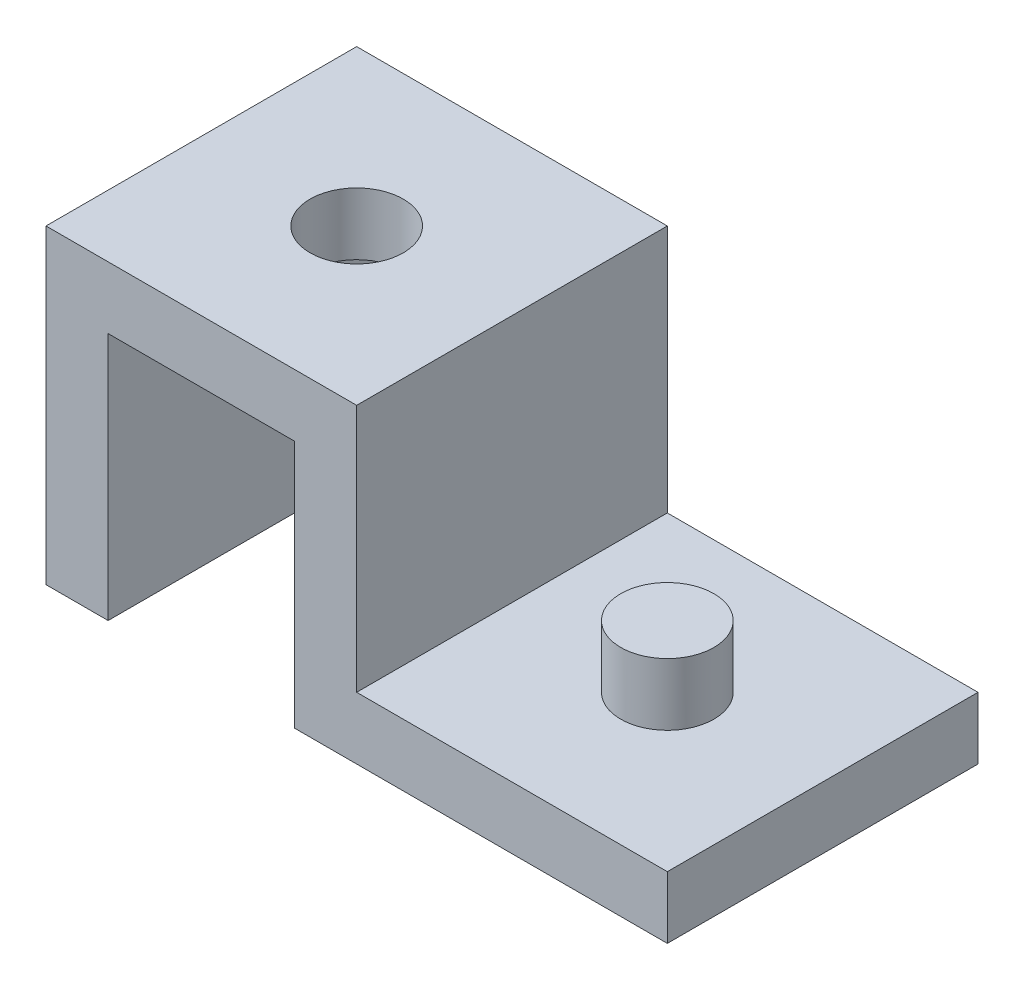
SolidWorks part; units mm, degrees
ref_plane "正面" through (0, 0, 0) normal (0, 0, 1) x (1, 0, 0)
ref_plane "平面" through (0, 0, 0) normal (0, 1, 0) x (1, 0, 0)
ref_plane "右側面" through (0, 0, 0) normal (1, 0, 0) x (0, 0, -1)
sketch "ｽｹｯﾁ1" plane through (0, 0, 0) normal (0, 1, 0) x (1, 0, 0)
  line L1 (0, 0) -> (100, 0)
  line L2 (0, 0) -> (0, 50)
  line L3 (0, 50) -> (100, 50)
  line L4 (100, 0) -> (100, 50)
  dimension "D1" = 100
  dimension "D2" = 50
extrude "押し出し1" add sketch "ｽｹｯﾁ1" along normal blind 50
sketch "ｽｹｯﾁ2" plane through (0, 0, 0) normal (0, 0, 1) x (1, 0, 0)
  line L0 (0, 0) -> (100, 0) construction
  line L1 (100, 50) -> (50, 50)
  line L2 (100, 50) -> (100, 10)
  line L3 (100, 10) -> (50, 10)
  line L4 (50, 50) -> (50, 10)
  line L5 (0, 50) -> (0, 0) construction
  dimension "D1" = 10
  dimension "D2" = 50
extrude "ｶｯﾄ - 押し出し1" cut sketch "ｽｹｯﾁ2" against normal through all
sketch "ｽｹｯﾁ3" plane through (0, 0, 0) normal (0, 0, 1) x (1, 0, 0)
  line L0 (0, 0) -> (100, 0) construction
  line L1 (10, 0) -> (40, 0)
  line L2 (10, 0) -> (10, 40)
  line L3 (10, 40) -> (40, 40)
  line L4 (40, 0) -> (40, 40)
  line L5 (0, 50) -> (0, 0) construction
  dimension "D1" = 10
  dimension "D2" = 30
  dimension "D3" = 40
extrude "ｶｯﾄ - 押し出し2" cut sketch "ｽｹｯﾁ3" against normal through all
sketch "ｽｹｯﾁ4" plane through (0, 50, 0) normal (0, 1, 0) x (1, 0, 0)
  line L0 (0, 25) -> (100, 25) construction
  line L1 (0, 50) -> (0, 0) construction
  line L2 (100, 50) -> (100, 0) construction
  circle A0 centre (25, 25) radius 7.5
  dimension "D1" = 15
  dimension "D2" = 25
extrude "ｶｯﾄ - 押し出し3" cut sketch "ｽｹｯﾁ4" against normal through all
sketch "ｽｹｯﾁ5" plane through (0, 0, 0) normal (0, -1, 0) x (1, 0, 0)
  line L0 (0, -25) -> (100, -25) construction
  line L1 (0, -50) -> (0, 0) construction
  line L2 (100, -50) -> (100, 0) construction
  circle A0 centre (75, -25) radius 7.5
  circle A1 centre (25, -25) radius 7.5 construction
  dimension "D1" = 15
  dimension "D2" = 50
extrude "押し出し2" add sketch "ｽｹｯﾁ5" against normal blind 20
